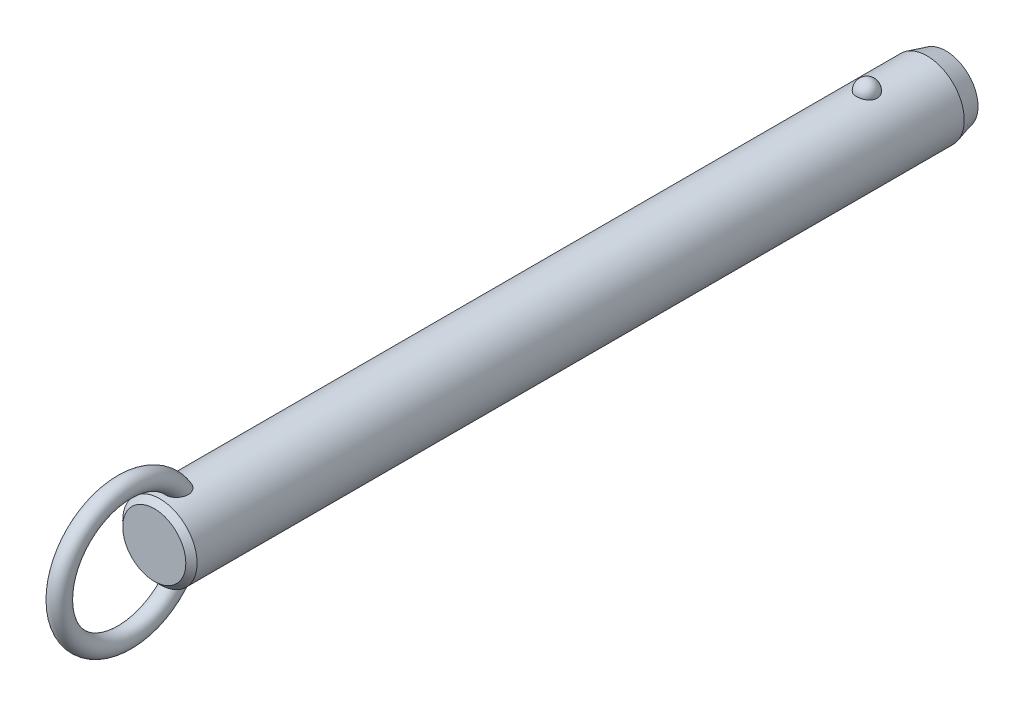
SolidWorks part; units mm, degrees
ref_plane "Front Plane" through (0, 0, 0) normal (0, 0, 1) x (1, 0, 0)
ref_plane "Top Plane" through (0, 0, 0) normal (0, 1, 0) x (1, 0, 0)
ref_plane "Right Plane" through (0, 0, 0) normal (1, 0, 0) x (0, 0, -1)
sketch "Sketch2" plane through (0, 0, 0) normal (0, 0, 1) x (1, 0, 0)
  circle A0 centre (0, 0) radius 7.9
  point P3 (0, 7.9)
  dimension "D1" = 15.8
extrude "Boss-Extrude1" add sketch "Sketch2" along normal blind 139.7
sketch "Sketch3" plane through (0, 0, 0) normal (0, 0, -1) x (-1, 0, 0)
  circle A0 centre (0, 0) radius 7.9
  dimension "D1" = 15.8
extrude "Boss-Extrude2" add sketch "Sketch3" along normal blind 19
chamfer "Chamfer1" distance 4 angle 15 1 edges at (-7.9, 0, -19)
sketch "Sketch12" plane through (0, 0, 0) normal (1, 0, 0) x (0, 0, -1)
  line L0 (-139.7, 7.9) -> (-139.7, -7.9) construction
  point P0 (-139.7, 0)
sketch "Sketch13" plane through (0, 0, 0) normal (1, 0, 0) x (0, 0, -1)
  circle A0 centre (-155.55, 0) radius 15.85
  point P2 (-139.7, 0)
  dimension "D1" = 31.7
sketch "Sketch14" plane through (0, 0, 0) normal (0, 1, 0) x (1, 0, 0)
  circle A0 centre (0, -141.7) radius 2
  point P2 (0, -139.7)
  dimension "D1" = 4
sweep "Sweep1" add profiles "Sketch14" path "Sketch13"
sketch "Sketch15" plane through (0, 0, 139.7) normal (0, 0, 1) x (1, 0, 0)
  circle A0 centre (0, 0) radius 7.9
  dimension "D1" = 15.8
extrude "Boss-Extrude3" add sketch "Sketch15" along normal blind 9.52
chamfer "Chamfer2" distance 1.2 angle 45 1 edges at (7.9, 0, 149.22)
sketch "Sketch18" plane through (0, 0, 0) normal (1, 0, 0) x (0, 0, -1)
  line L0 (15, 7.9) -> (-141.8091, 7.9) construction
  line L1 (2.2, 10.1) -> (2.2, 5.7)
  line L2 (-141.8091, -7.9) -> (15, -7.9) construction
  arc A0 (2.2, 10.1) -> (2.2, 5.7) centre (2.2, 7.9) ccw
  point P4 (0, 7.9)
  dimension "D1" = 18
revolve "Revolve1" add sketch "Sketch18" angle 360 about L1
